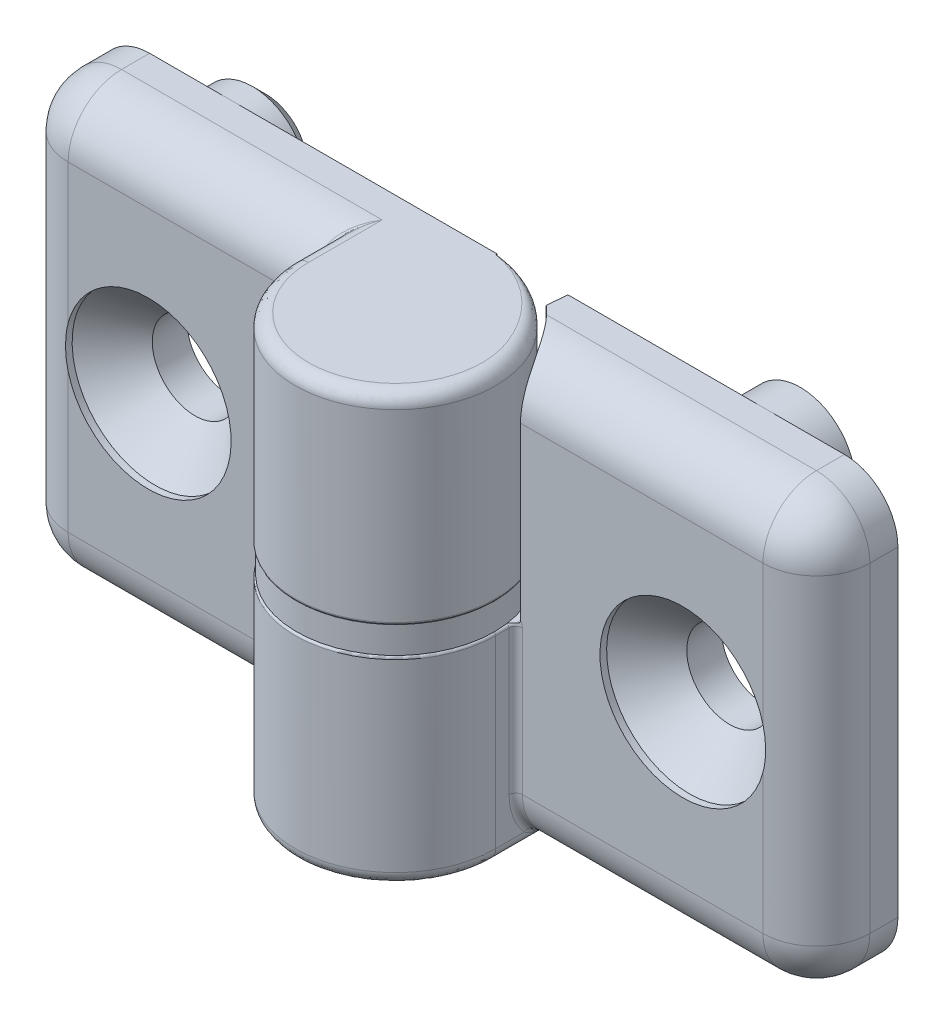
SolidWorks part; units mm, degrees
ref_plane "Ebene vorne" through (0, 0, 0) normal (0, 0, 1) x (1, 0, 0)
ref_plane "Ebene oben" through (0, 0, 0) normal (0, 1, 0) x (1, 0, 0)
ref_plane "Ebene rechts" through (0, 0, 0) normal (1, 0, 0) x (0, 0, -1)
imported_body "095020rr_1-3-solid1"
imported_body "095020rr_1-4-solid1"
imported_body "095020-02e_2-2-solid1"
imported_body "095020-01_2-2-solid1"
move or copy body "Körper-Verschieben/Kopieren1" bodies to move or copy 104 103 copy no rotation origin (0, 0, 0) rotation axis (0, 1, 0) rotation angle 5
move or copy body "Körper-Verschieben/Kopieren2" bodies to move or copy 108 106 107 copy no rotation origin (0, 0, 0.9211) rotation axis (0, 1, 0) rotation angle 180
